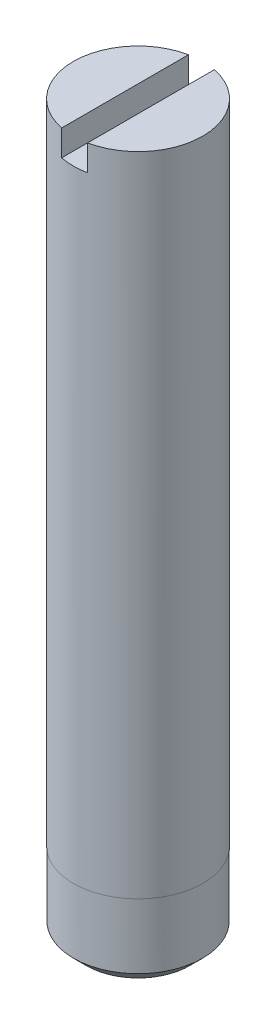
SolidWorks part; units mm, degrees
ref_plane "Front" through (0, 0, 0) normal (0, 0, 1) x (1, 0, 0)
ref_plane "Top" through (0, 0, 0) normal (0, 1, 0) x (1, 0, 0)
ref_plane "Right" through (0, 0, 0) normal (1, 0, 0) x (0, 0, -1)
sketch "Sketch1" plane through (0, 0, 0) normal (0, 1, 0) x (1, 0, 0)
  circle A0 centre (0, 0) radius 2.5
extrude "Extrude1" add sketch "Sketch1" along normal blind 28
sketch "Sketch2" plane through (0, 28, 0) normal (0, 1, 0) x (-1, 0, 0)
  line L1 (0.5, -3.5855) -> (0.5, 3.8897)
  line L2 (-0.5, -3.5855) -> (-0.5, 4.0076)
  line L5 (0.5, -3.5855) -> (-0.5, -3.5855)
  line L6 (0.5, 3.8897) -> (-0.5, 4.0076)
extrude "Cut-Extrude1" cut sketch "Sketch2" against normal blind 1
chamfer "Chamfer1" distance 0.5 angle 45 1 edges at (0, 0, 2.5)
sketch "Sketch3" plane through (0, 0, 0) normal (0, -1, 0) x (1, 0, 0)
  circle A0 centre (0, 0) radius 2.5
  circle A1 centre (0, 0) radius 2.49
extrude "Cut-Extrude2" cut sketch "Sketch3" against normal blind 3
